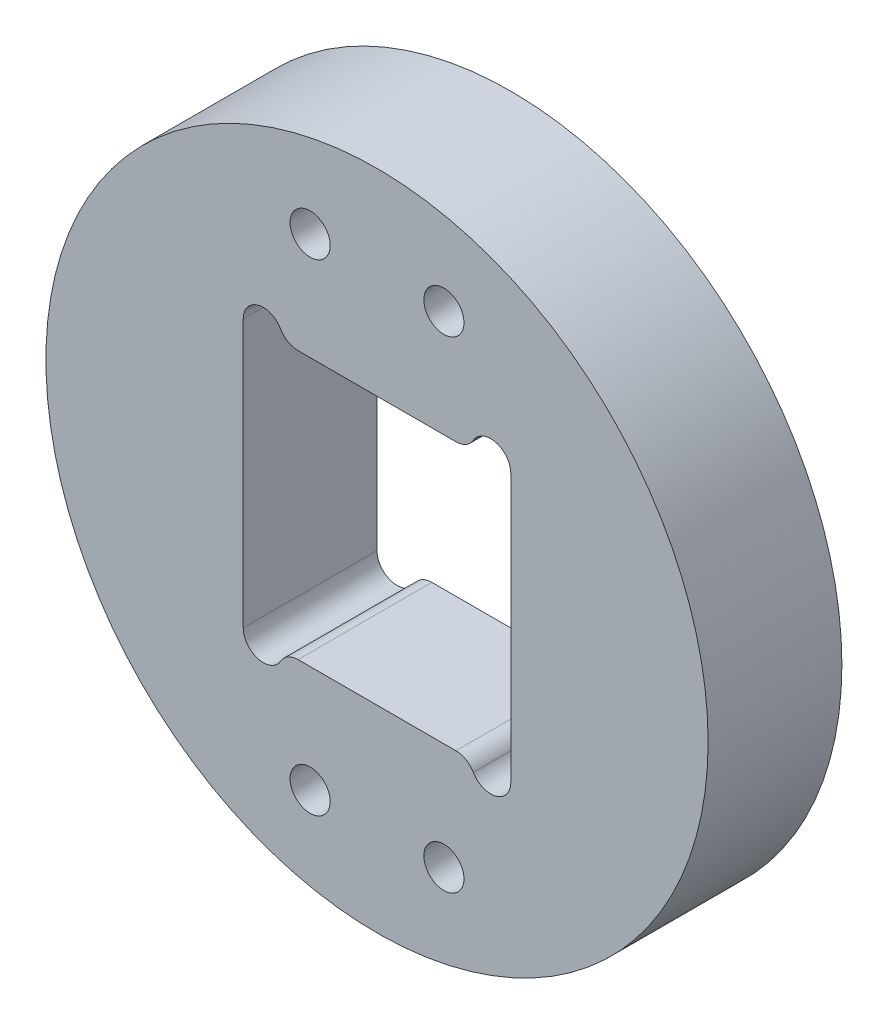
SolidWorks part; units mm, degrees
ref_plane "Plan de face" through (0, 0, 0) normal (0, 0, 1) x (1, 0, 0)
ref_plane "Plan de dessus" through (0, 0, 0) normal (0, 1, 0) x (1, 0, 0)
ref_plane "Plan de droite" through (0, 0, 0) normal (1, 0, 0) x (0, 0, -1)
sketch "Esquisse1" plane through (0, 0, 0) normal (0, 0, 1) x (1, 0, 0)
  line L4 (-5.9019, 10) -> (5.9019, 10)
  line L5 (10, 10) -> (10, -10)
  line L6 (5.9019, -10) -> (-5.9019, -10)
  line L7 (-10, -10) -> (-10, 10)
  line L8 (55, 0) -> (-55, 0) construction
  arc A0 (-7.201, 10.75) -> (-5.9019, 10) centre (-5.9019, 11.5) ccw
  arc A1 (5.9019, 10) -> (7.201, 10.75) centre (5.9019, 11.5) ccw
  arc A2 (10, 10) -> (7.201, 10.75) centre (8.5, 10) ccw
  arc A3 (7.201, -10.75) -> (10, -10) centre (8.5, -10) ccw
  arc A4 (7.201, -10.75) -> (5.9019, -10) centre (5.9019, -11.5) ccw
  arc A18 (-5.9019, -10) -> (-7.201, -10.75) centre (-5.9019, -11.5) ccw
  arc A19 (-10, -10) -> (-7.201, -10.75) centre (-8.5, -10) ccw
  arc A20 (-7.201, 10.75) -> (-10, 10) centre (-8.5, 10) ccw
  circle A24 centre (-5, 18) radius 1.5
  circle A25 centre (0, 0) radius 24.75
  circle A26 centre (5, 18) radius 1.5
  circle A27 centre (5, -18) radius 1.5
  circle A28 centre (-5, -18) radius 1.5
  dimension "D5" = 1.5
  dimension "D6" = 1.5
  dimension "D7" = 1.5
  dimension "D8" = 1.5
  dimension "D9" = 1.5
  dimension "D10" = 1.5
  dimension "D11" = 1.5
  dimension "D12" = 1.5
  dimension "D15" = 3
  dimension "D16" = 49.5
  dimension "D1" = 20
  dimension "D2" = 20
  dimension "D3" = 10
  dimension "D4" = 10
  dimension "D13" = 18
  dimension "D14" = 5
  dimension "D17" = 2
extrude "Boss.-Extru.1" add sketch "Esquisse1" along normal blind 10
chamfer "Chanfrein1" distance 2.2 angle 45 4 edges at (-6.5, -18, 0) (3.5, -18, 0) (-3.5, 18, 0) (6.5, 18, 0)
